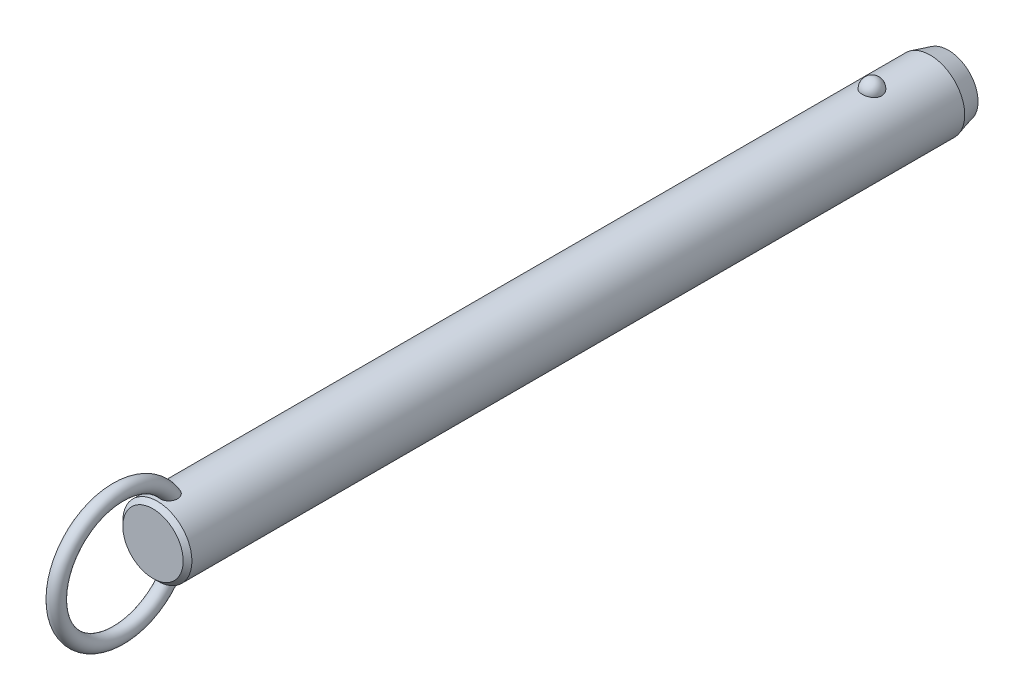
SolidWorks part; units mm, degrees
ref_plane "Front Plane" through (0, 0, 0) normal (0, 0, 1) x (1, 0, 0)
ref_plane "Top Plane" through (0, 0, 0) normal (0, 1, 0) x (1, 0, 0)
ref_plane "Right Plane" through (0, 0, 0) normal (1, 0, 0) x (0, 0, -1)
sketch "Sketch2" plane through (0, 0, 0) normal (0, 0, 1) x (1, 0, 0)
  circle A0 centre (0, 0) radius 9.5
  point P3 (0, 9.5)
  dimension "D1" = 19
extrude "Boss-Extrude1" add sketch "Sketch2" along normal blind 185.4
sketch "Sketch3" plane through (0, 0, 0) normal (0, 0, -1) x (-1, 0, 0)
  circle A0 centre (0, 0) radius 9.5
  dimension "D1" = 19
extrude "Boss-Extrude2" add sketch "Sketch3" along normal blind 23.7
chamfer "Chamfer1" distance 5 angle 15 1 edges at (-9.5, 0, -23.7)
sketch "Sketch12" plane through (0, 0, 0) normal (1, 0, 0) x (0, 0, -1)
  line L0 (-185.4, 9.5) -> (-185.4, -9.5) construction
  point P0 (-185.4, 0)
sketch "Sketch13" plane through (0, 0, 0) normal (1, 0, 0) x (0, 0, -1)
  circle A0 centre (-204.45, 0) radius 19.05
  point P2 (-185.4, 0)
  dimension "D1" = 38.1
sketch "Sketch14" plane through (0, 0, 0) normal (0, 1, 0) x (1, 0, 0)
  circle A0 centre (0, -187.4) radius 2
  point P2 (0, -185.4)
  dimension "D1" = 4
sweep "Sweep1" add profiles "Sketch14" path "Sketch13"
sketch "Sketch15" plane through (0, 0, 185.4) normal (0, 0, 1) x (1, 0, 0)
  circle A0 centre (0, 0) radius 9.5
  dimension "D1" = 19
extrude "Boss-Extrude3" add sketch "Sketch15" along normal blind 9.52
chamfer "Chamfer2" distance 1.2 angle 45 1 edges at (9.5, 0, 194.92)
sketch "Sketch18" plane through (0, 0, 0) normal (1, 0, 0) x (0, 0, -1)
  line L0 (18.7, 9.5) -> (-187.9378, 9.5) construction
  line L1 (2.7, 12.2) -> (2.7, 6.8)
  line L2 (-187.9378, -9.5) -> (18.7, -9.5) construction
  arc A0 (2.7, 12.2) -> (2.7, 6.8) centre (2.7, 9.5) ccw
  point P4 (0, 9.5)
  dimension "D1" = 21.7
revolve "Revolve1" add sketch "Sketch18" angle 360 about L1
